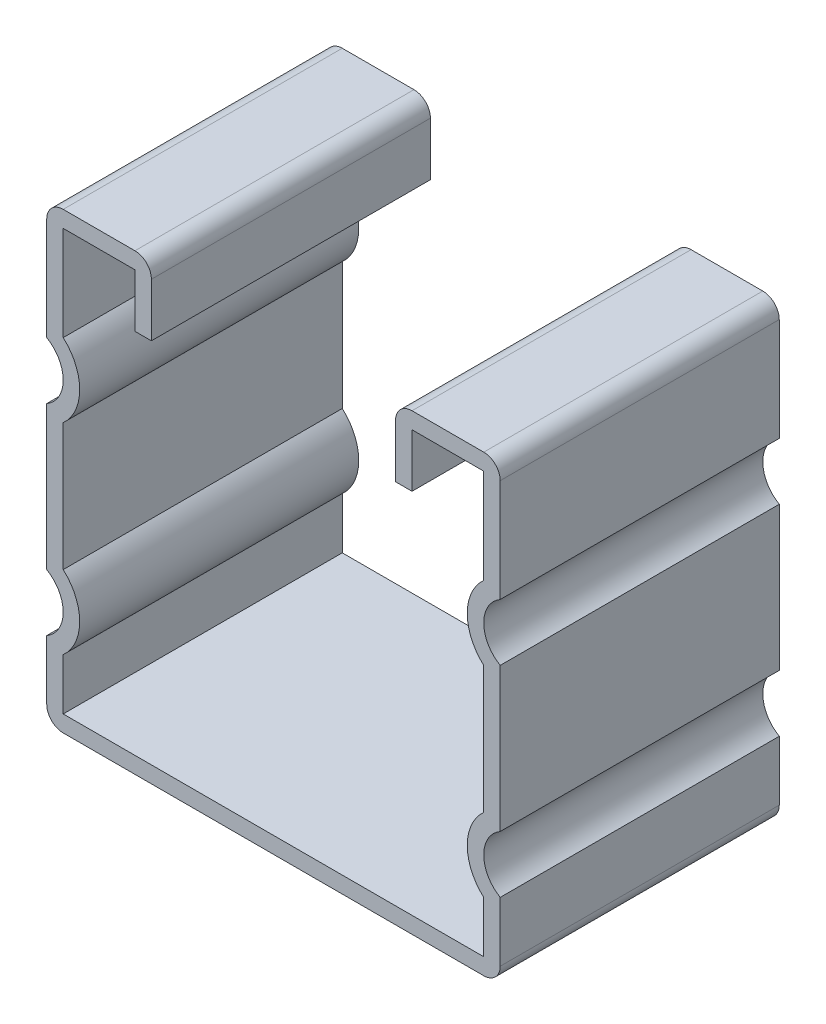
SolidWorks part; units mm, degrees
ref_plane "Plane1" through (0, 0, 0) normal (0, 0, 1) x (1, 0, 0)
ref_plane "Plane2" through (0, 0, 0) normal (0, 1, 0) x (1, 0, 0)
ref_plane "Plane3" through (0, 0, 0) normal (1, 0, 0) x (0, 0, -1)
sketch "Sketch1" plane through (0, 0, 0) normal (0, 0, 1) x (1, 0, 0)
  line L0 (-20.6375, 21.1074) -> (-20.6375, 11.7397)
  line L1 (-20.6375, 6.5483) -> (-20.6375, -6.5483)
  line L2 (-19.1389, -18.669) -> (19.1389, -18.669)
  line L3 (20.6375, -17.1704) -> (20.6375, -11.7397)
  line L4 (20.6375, 11.7397) -> (20.6375, 21.1074)
  line L5 (19.1389, 22.606) -> (12.6111, 22.606)
  line L6 (11.1125, 21.1074) -> (11.1125, 16.256)
  line L7 (-19.1389, 22.606) -> (-12.6111, 22.606)
  line L8 (-11.1125, 21.1074) -> (-11.1125, 16.256)
  line L9 (19.1389, -12.495) -> (19.1389, 12.495) construction
  line L10 (-19.1389, 12.495) -> (-19.1389, -12.495) construction
  line L11 (-12.6111, 21.1074) -> (-12.6111, 16.256)
  line L12 (-19.1389, 21.1074) -> (-12.6111, 21.1074)
  line L13 (-19.1389, 21.1074) -> (-19.1389, 12.495)
  line L14 (-19.1389, 5.793) -> (-19.1389, -5.793)
  line L15 (-19.1389, -17.1704) -> (19.1389, -17.1704)
  line L16 (19.1389, -17.1704) -> (19.1389, -12.495)
  line L17 (19.1389, 12.495) -> (19.1389, 21.1074)
  line L18 (19.1389, 21.1074) -> (12.6111, 21.1074)
  line L19 (12.6111, 21.1074) -> (12.6111, 16.256)
  line L20 (-12.6111, 16.256) -> (-11.1125, 16.256)
  line L21 (11.1125, 16.256) -> (12.6111, 16.256)
  line L22 (-10.16, 0) -> (12.7, 0) construction
  line L23 (-20.6375, -11.7397) -> (-20.6375, -17.1704)
  line L24 (-19.1389, -12.495) -> (-19.1389, -17.1704)
  line L25 (20.6375, -6.5483) -> (20.6375, 6.5483)
  line L26 (19.1389, -5.793) -> (19.1389, 5.793)
  arc A0 (20.6375, 11.7397) -> (20.6375, 6.5483) centre (22.1361, 9.144) ccw
  arc A1 (-20.6375, 6.5483) -> (-20.6375, 11.7397) centre (-22.1361, 9.144) ccw
  arc A2 (-12.6111, 22.606) -> (-11.1125, 21.1074) centre (-12.6111, 21.1074) cw
  arc A3 (-20.6375, 21.1074) -> (-19.1389, 22.606) centre (-19.1389, 21.1074) cw
  arc A4 (-19.1389, -18.669) -> (-20.6375, -17.1704) centre (-19.1389, -17.1704) cw
  arc A5 (20.6375, -17.1704) -> (19.1389, -18.669) centre (19.1389, -17.1704) cw
  arc A6 (19.1389, 22.606) -> (20.6375, 21.1074) centre (19.1389, 21.1074) cw
  arc A7 (11.1125, 21.1074) -> (12.6111, 22.606) centre (12.6111, 21.1074) cw
  arc A8 (-19.1389, 5.793) -> (-19.1389, 12.495) centre (-22.1361, 9.144) ccw
  arc A9 (19.1389, 12.495) -> (19.1389, 5.793) centre (22.1361, 9.144) ccw
  arc A10 (20.6375, -11.7397) -> (20.6375, -6.5483) centre (22.1361, -9.144) cw
  arc A11 (19.1389, -12.495) -> (19.1389, -5.793) centre (22.1361, -9.144) cw
  arc A12 (-19.1389, -5.793) -> (-19.1389, -12.495) centre (-22.1361, -9.144) cw
  arc A13 (-20.6375, -6.5483) -> (-20.6375, -11.7397) centre (-22.1361, -9.144) cw
  dimension "D1" = 20.6375
  dimension "D9" = 2.9972
  dimension "D10" = 2.9972
  dimension "D2" = 9.525
  dimension "Width" = 41.275
  dimension "base" = 18.669
  dimension "ToeHt" = 22.606
  dimension "D6" = 22.225
  dimension "edge" = 9.525
  dimension "Lip" = 6.35
  dimension "gauge" = 1.4986
extrude "Base-Extrude" add sketch "Sketch1" along normal mid plane 25.4
equation "\"D1@Sketch1\" = \"Width@Sketch1\" / 2"
equation "\"D6@Sketch1\" = \"Width@Sketch1\" - 2 * \"edge@Sketch1\""
equation "\"D10@Sketch1\" = 2 * \"gauge@Sketch1\""
equation "\"D9@Sketch1\" = \"D10@Sketch1\""
equation "\"D2@Sketch1\" = \"edge@Sketch1\""
